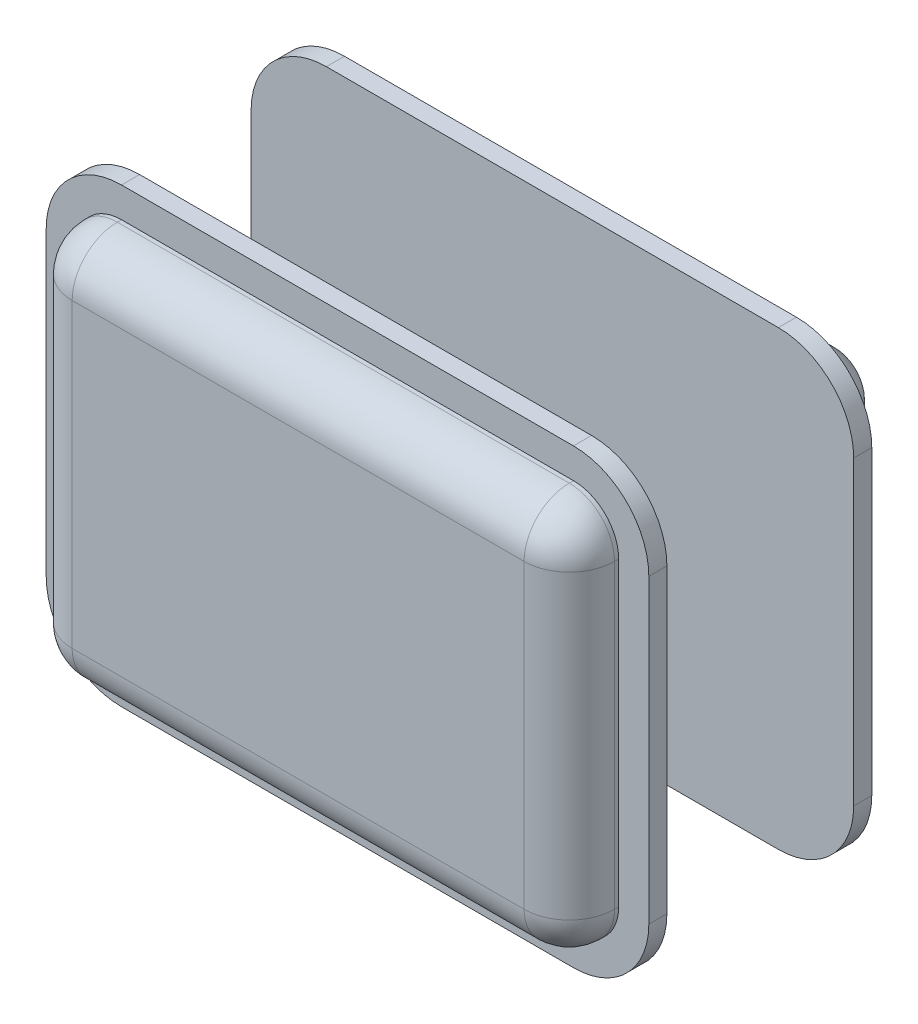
SolidWorks part; units mm, degrees
ref_plane "Plan de face" through (0, 0, 0) normal (0, 0, 1) x (1, 0, 0)
ref_plane "Plan de dessus" through (0, 0, 0) normal (0, 1, 0) x (1, 0, 0)
ref_plane "Plan de droite" through (0, 0, 0) normal (1, 0, 0) x (0, 0, -1)
sketch "Esquisse1" plane through (0, 0, 0) normal (0, 0, 1) x (1, 0, 0)
  line L1 (-35, 75) -> (115, 75)
  line L2 (-60, 50) -> (-60, -50)
  line L3 (-35, -75) -> (115, -75)
  line L4 (140, 50) -> (140, -50)
  arc A0 (115, -75) -> (140, -50) centre (115, -50) ccw
  arc A1 (-60, -50) -> (-35, -75) centre (-35, -50) ccw
  arc A2 (-35, 75) -> (-60, 50) centre (-35, 50) ccw
  arc A3 (115, 75) -> (140, 50) centre (115, 50) cw
  dimension "D5" = 25
  dimension "D1" = 200
  dimension "D2" = 60
  dimension "D3" = 150
  dimension "D4" = 75
extrude "Boss.-Extru.1" add sketch "Esquisse1" along normal blind 6 from offset 31
sketch "Esquisse2" plane through (0, 0, 37) normal (0, 0, 1) x (1, 0, 0)
  line L12 (130, -50) -> (130, 50)
  line L13 (115, 65) -> (-35, 65)
  line L14 (-50, 50) -> (-50, -50)
  line L15 (-35, -65) -> (115, -65)
  line L16 (130, -50) -> (130, 50)
  line L17 (115, 65) -> (-35, 65)
  line L18 (-50, 50) -> (-50, -50)
  line L19 (-35, -65) -> (115, -65)
  arc A12 (115, -65) -> (130, -50) centre (115, -50) ccw
  arc A13 (130, 50) -> (115, 65) centre (115, 50) ccw
  arc A14 (-35, 65) -> (-50, 50) centre (-35, 50) ccw
  arc A15 (-50, -50) -> (-35, -65) centre (-35, -50) ccw
  arc A16 (115, -65) -> (130, -50) centre (115, -50) ccw
  arc A17 (130, 50) -> (115, 65) centre (115, 50) ccw
  arc A18 (-35, 65) -> (-50, 50) centre (-35, 50) ccw
  arc A19 (-50, -50) -> (-35, -65) centre (-35, -50) ccw
  dimension "D1" = 10
extrude "ballast p-v" add sketch "Esquisse2" along normal blind 16.4
fillet "Congé1" radius 15 8 edges at (40, -65, 53.4) (-45.6066, -60.6066, 53.4) (-50, 0, 53.4) (-45.6066, 60.6066, 53.4) (40, 65, 53.4) (125.6066, 60.6066, 53.4) (130, 0, 53.4) (125.6066, -60.6066, 53.4)
sketch "Esquisse4" plane through (0, 0, 0) normal (0, 0, 1) x (1, 0, 0)
  circle A0 centre (0, 0) radius 7
  dimension "D1" = 14
extrude "Boss.-Extru.3" add sketch "Esquisse4" along normal mid plane 62
sketch "Esquisse5" plane through (0, 0, 0) normal (1, 0, 0) x (0, 0, -1)
  circle A0 centre (0, 0) radius 7
  dimension "D1" = 14
extrude "Boss.-Extru.4" add sketch "Esquisse5" against normal blind 90 and the other way blind 12
sketch "Esquisse6" plane through (0, 0, 0) normal (0, 1, 0) x (1, 0, 0)
  line L1 (-11, 11) -> (11, 11)
  line L2 (-11, 11) -> (-11, -11)
  line L3 (-11, -11) -> (11, -11)
  line L4 (11, 11) -> (11, -11)
  dimension "D1" = 22
  dimension "D2" = 11
  dimension "D3" = 11
  dimension "D4" = 22
extrude "Boss.-Extru.5" add sketch "Esquisse6" along normal mid plane 22
mirror "Symétrie1" about plane through (0, 0, 0) normal (0, 0, 1) of "Congé1", "ballast p-v", "Boss.-Extru.1"
